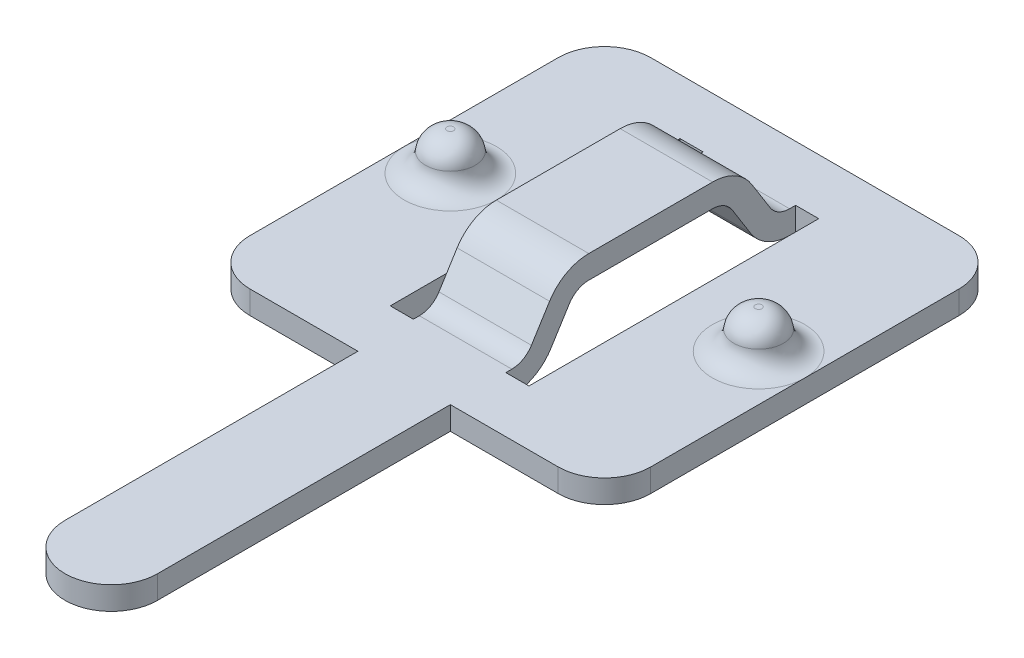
SolidWorks part; units mm, degrees
ref_plane "Face" through (0, 0, 0) normal (0, 0, 1) x (1, 0, 0)
ref_plane "Dessus" through (0, 0, 0) normal (0, 1, 0) x (1, 0, 0)
ref_plane "Droite" through (0, 0, 0) normal (1, 0, 0) x (0, 0, -1)
sketch "Esquisse3" plane through (0, 0, 0) normal (0, 1, 0) x (1, 0, 0)
  line L0 (-4.0599, 0) -> (18.6599, 0) construction
  line L1 (0, 6.5) -> (10, 6.5)
  line L2 (-1.5, 5) -> (-1.5, -5)
  line L3 (0, -6.5) -> (3.5, -6.5)
  line L4 (11.5, 5) -> (11.5, -5)
  line L6 (3.5, -6.5) -> (3.5, -16)
  line L7 (2.75, 4.7) -> (7.25, 4.7)
  line L8 (6.5, -6.5) -> (6.5, -16)
  line L9 (5, 31.4165) -> (5, -3.4118) construction
  line L10 (6.5, -6.5) -> (10, -6.5)
  line L11 (2.75, 4.7) -> (2.75, -4.7)
  line L12 (2.75, -4.7) -> (7.25, -4.7)
  line L13 (7.25, 4.7) -> (7.25, -4.7)
  arc A0 (3.5, -16) -> (6.5, -16) centre (5, -16) ccw
  circle A1 centre (10, 0) radius 1.48
  circle A2 centre (0, 0) radius 1.48
  arc A3 (-1.5, -5) -> (0, -6.5) centre (0, -5) ccw
  arc A4 (0, 6.5) -> (-1.5, 5) centre (0, 5) ccw
  arc A5 (10, 6.5) -> (11.5, 5) centre (10, 5) cw
  arc A6 (10, -6.5) -> (11.5, -5) centre (10, -5) ccw
  point P25 (-1.5, 6.5)
  point P28 (11.5, 6.5)
  point P31 (11.5, -6.5)
  dimension "D5" = 2.96
  dimension "D9" = 1.5
  dimension "D1" = 13
  dimension "D2" = 13
  dimension "D3" = 9.5
  dimension "D4" = 3
  dimension "D6" = 5
  dimension "D7" = 4.5
  dimension "D8" = 9.4
extrude "Extrusion2" add sketch "Esquisse3" along normal blind 0.75
sketch "Esquisse1" plane through (0, 0, 0) normal (0, 0, 1) x (1, 0, 0)
  line L0 (0, 0) -> (0, 15.8193) construction
  line L1 (0, 2) -> (0, 0.9)
  line L3 (0, 2) -> (0.1081, 2)
  line L5 (1.5, 0) -> (1.5, 0.75)
  arc A0 (0.804, 1.375) -> (1.5, 0.75) centre (1.5, 1.45) ccw
  arc A1 (0.804, 1.375) -> (0.1081, 2) centre (0.1081, 1.3) ccw
  arc A2 (0.2206, 0.7676) -> (1.5, 0) centre (1.5, 1.45) ccw
  arc A3 (0.2206, 0.7676) -> (0, 0.9) centre (0, 0.65) ccw
  dimension "D1" = 1.4
  dimension "D2" = 1.4
  dimension "D3" = 0.5
  dimension "D4" = 1.5
  dimension "D6" = 0.75
revolve "Révolution1" add sketch "Esquisse1" angle 360 about L0
pattern_linear "Répétition linéaire1" count 2 spacing 10 along (1, 0, 0) of "Révolution1"
ref_plane "Plan1" through (5, 0, 0) normal (1, 0, 0) x (0, 0, -1)
sketch "Esquisse4" plane through (5, 0, 0) normal (1, 0, 0) x (0, 0, -1)
  line L0 (-2.0088, 2.75) -> (2.0088, 2.75)
  line L1 (3.2809, 2.0449) -> (3.8697, 1.1026)
  line L2 (4.5057, 0.75) -> (4.7, 0.75)
  line L3 (4.7, 0.75) -> (4.7, 0)
  line L4 (4.7, 0) -> (4.5057, 0)
  line L5 (3.2337, 0.7051) -> (2.6448, 1.6474)
  line L6 (2.0088, 2) -> (-2.0088, 2)
  line L7 (-2.6448, 1.6474) -> (-3.2337, 0.7051)
  line L8 (-4.5057, 0) -> (-4.7, 0)
  line L9 (-4.7, 0) -> (-4.7, 0.75)
  line L10 (-4.7, 0.75) -> (-4.5057, 0.75)
  line L11 (-3.8697, 1.1026) -> (-3.2809, 2.0449)
  line L12 (-5, 0) -> (5, 0) construction
  arc A0 (4.5057, 0) -> (3.2337, 0.7051) centre (4.5057, 1.5) cw
  arc A1 (-3.2337, 0.7051) -> (-4.5057, 0) centre (-4.5057, 1.5) cw
  arc A2 (-4.5057, 0.75) -> (-3.8697, 1.1026) centre (-4.5057, 1.5) ccw
  arc A3 (3.8697, 1.1026) -> (4.5057, 0.75) centre (4.5057, 1.5) ccw
  arc A4 (2.6448, 1.6474) -> (2.0088, 2) centre (2.0088, 1.25) ccw
  arc A5 (-2.0088, 2) -> (-2.6448, 1.6474) centre (-2.0088, 1.25) ccw
  arc A6 (2.0088, 2.75) -> (3.2809, 2.0449) centre (2.0088, 1.25) cw
  arc A7 (-3.2809, 2.0449) -> (-2.0088, 2.75) centre (-2.0088, 1.25) cw
  point P25 (-4.09, 0.75)
  point P28 (4.09, 0.75)
  dimension "D9" = 1.5
  dimension "D10" = 0.75
  dimension "D11" = 1.5
  dimension "D1" = 2.75
  dimension "D2" = 4.09
  dimension "D3" = 4.09
  dimension "D4" = 122
  dimension "D5" = 122
  dimension "D6" = 0.75
  dimension "D7" = 0.75
  dimension "D8" = 0.75
extrude "Extrusion3" add sketch "Esquisse4" along normal mid plane 3
